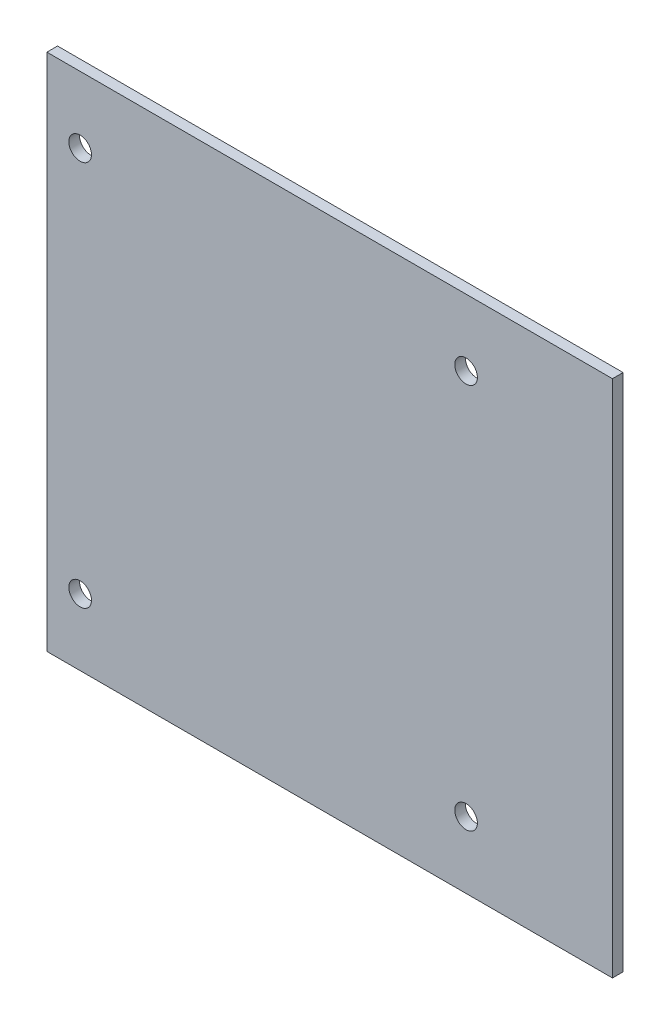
SolidWorks part; units mm, degrees
ref_plane "前视基准面" through (0, 0, 0) normal (0, 0, 1) x (1, 0, 0)
ref_plane "上视基准面" through (0, 0, 0) normal (0, 1, 0) x (1, 0, 0)
ref_plane "右视基准面" through (0, 0, 0) normal (1, 0, 0) x (0, 0, -1)
sketch "草图1" plane through (0, 0, 0) normal (0, 0, 1) x (1, 0, 0)
  line L1 (-42.5, 39) -> (42.5, 39)
  line L2 (-42.5, 39) -> (-42.5, -39)
  line L3 (-42.5, -39) -> (42.5, -39)
  line L4 (42.5, 39) -> (42.5, -39)
  line L5 (-42.5, 39) -> (42.5, -39) construction
  line L6 (-42.5, -39) -> (42.5, 39) construction
  point P0 (0, 0)
  dimension "D1" = 85
  dimension "D2" = 78
extrude "凸台-拉伸1" add sketch "草图1" along normal blind 1.6
sketch "草图2" plane through (0, 0, 0) normal (0, 0, -1) x (-1, 0, 0)
  circle A0 centre (37.5, -29) radius 1.7
  circle A1 centre (-20.5, -29) radius 1.7
  circle A2 centre (37.5, 29) radius 1.7
  circle A3 centre (-20.5, 29) radius 1.7
  dimension "D1" = 3.4
extrude "切除-拉伸1" cut sketch "草图2" against normal through all
